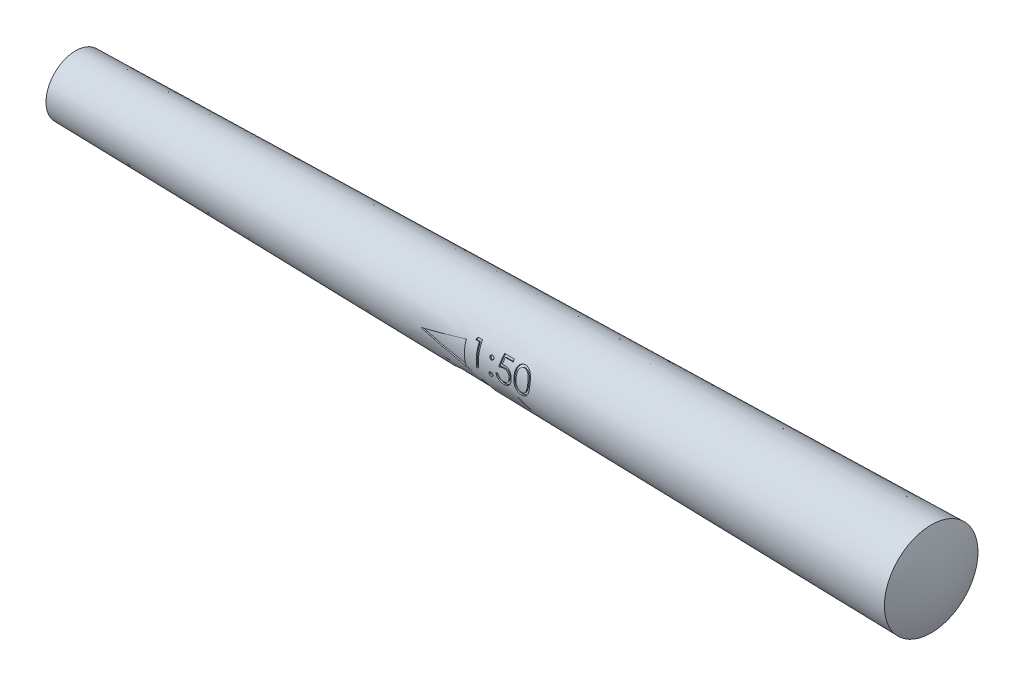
SolidWorks part; units mm, degrees
ref_plane "Front Plane" through (0, 0, 0) normal (0, 0, 1) x (1, 0, 0)
ref_plane "Top Plane" through (0, 0, 0) normal (0, 1, 0) x (1, 0, 0)
ref_plane "Right Plane" through (0, 0, 0) normal (1, 0, 0) x (0, 0, -1)
sketch "Sketch1" plane through (0, 0, 0) normal (1, 0, 0) x (0, 0, -1)
  circle A0 centre (0, 0) radius 1.25
  dimension "D1" = 2.5
extrude "Extrude1" add sketch "Sketch1" along normal mid plane 36
draft "Draft1" type of draft neutral plane draft angle 1.146 faces to draft 1 parameters "D1"=1.146
sketch "Sketch2" plane through (0, 0, 0) normal (0, 0, 1) x (1, 0, 0)
  line L0 (-18, 0) -> (-18, 1.25)
  line L1 (-18, 1.25) -> (-18, -1.25) construction
  line L2 (-18, 0) -> (-18.4, 0)
  line L3 (-18.4, 0) -> (-18.4, -1.61) construction
  line L4 (18, 0) -> (18, 1.97)
  line L5 (18, -1.97) -> (18, 1.97) construction
  line L6 (18, 0) -> (18.4, 0)
  line L7 (18.4, 0) -> (18.4, -1.61) construction
  line L8 (-18, -1.25) -> (18, -1.97) construction
  arc A0 (-18.4, 0) -> (-18, 1.25) centre (-16.2469, 0) cw
  arc A1 (18.4, 0) -> (18, 1.97) centre (13.3488, 0) ccw
  point P14 (0, -1.61)
revolve "Revolve1" add sketch "Sketch2" angle 360 about L2
sketch "Sketch5" plane through (0, 0, 0) normal (0, 0, 1) x (1, 0, 0)
  line L0 (0, 1.61) -> (0, -1.61) construction
  line L1 (18, 1.97) -> (-18, 1.25) construction
  line L2 (-18, -1.25) -> (18, -1.97) construction
ref_plane "Plane2" through (0, 0, 0) normal (-0.02, 0, 0.9998) x (0.9998, 0, 0.02)
sketch "Sketch6" plane through (0, 0, 0) normal (-0.02, 0, 0.9998) x (0.9998, 0, 0.02)
  line L0 (0, 0) -> (0, 0.5)
  line L1 (0, 1.61) -> (0, -1.61) construction
  line L2 (0, 0.5) -> (-1.866, 0)
  line L3 (-1.866, 0) -> (0, -0.5)
  line L4 (0, -0.5) -> (0, 0)
  line L5 (0, -0.25) -> (3, -0.25) construction
  text T0 "1:50" font "Century Gothic" height 1
  dimension "D1" = 1
  dimension "D2" = 30
  dimension "D3" = 3
wrap "Wrap2" sketch "Sketch6" wrap type deboss source sketch "Sketch6" thickness 0.05 parameters "D1"=0.05
equation "\"D2@Sketch2\" = \"D1@Sketch2\""
